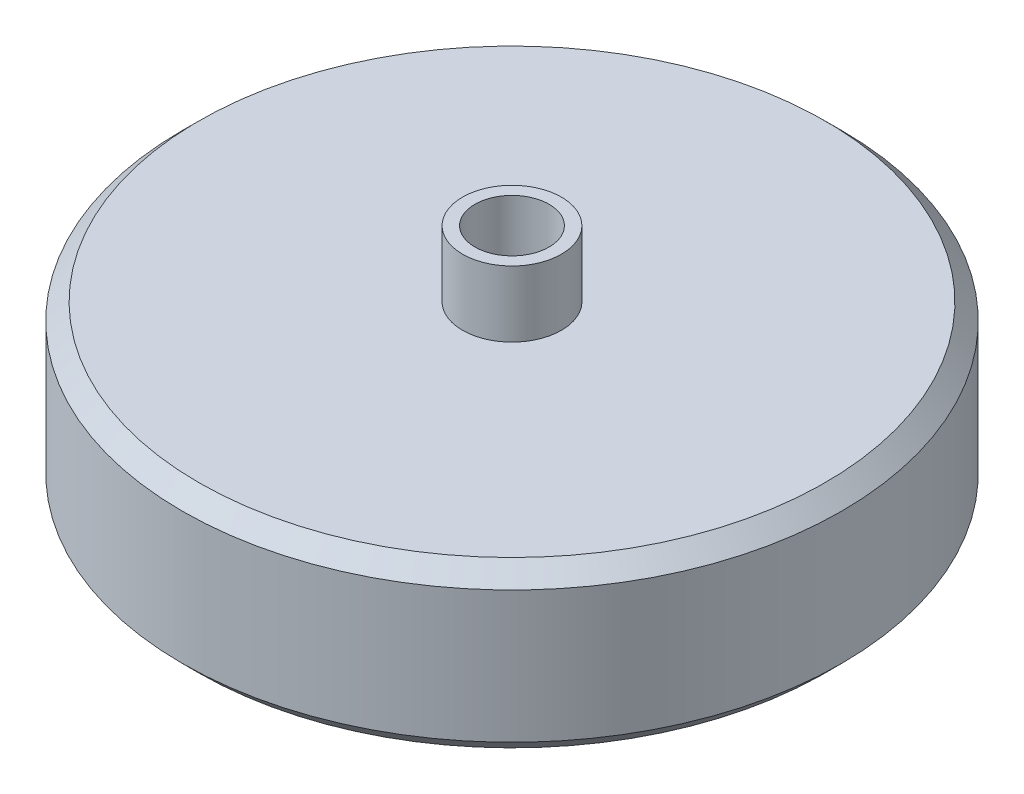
SolidWorks part; units mm, degrees
ref_plane "Front Plane" through (0, 0, 0) normal (0, 0, 1) x (1, 0, 0)
ref_plane "Top Plane" through (0, 0, 0) normal (0, 1, 0) x (1, 0, 0)
ref_plane "Right Plane" through (0, 0, 0) normal (1, 0, 0) x (0, 0, -1)
sketch "Sketch1" plane through (0, 0, 0) normal (0, 1, 0) x (1, 0, 0)
  circle A0 centre (0, 0) radius 20
  dimension "D1" = 40
extrude "Extrude1" add sketch "Sketch1" along normal blind 10
sketch "Sketch2" plane through (0, 10, 0) normal (0, 1, 0) x (1, 0, 0)
  circle A0 centre (0, 0) radius 3
  dimension "D1" = 6
extrude "Extrude2" add sketch "Sketch2" along normal blind 4
sketch "Sketch3" plane through (0, 0, 0) normal (0, -1, 0) x (1, 0, 0)
  circle A0 centre (0, 0) radius 3
  dimension "D1" = 6
extrude "Extrude3" add sketch "Sketch3" along normal blind 4
sketch "Sketch4" plane through (0, 14, 0) normal (0, 1, 0) x (1, 0, 0)
  circle A0 centre (0, 0) radius 2.25
  dimension "D1" = 4.5
extrude "Extrude4" cut sketch "Sketch4" against normal through all
chamfer "Chamfer1" distance 1 angle 45 2 edges at (0, 0, 20) (0, 10, 20)
